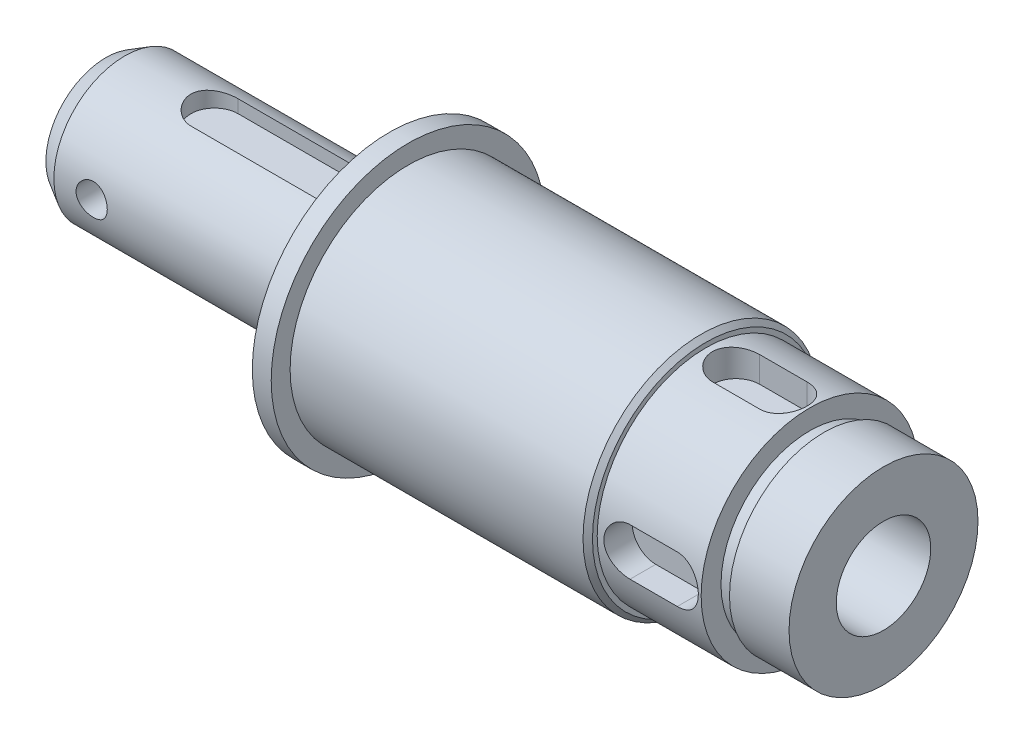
SolidWorks part; units mm, degrees
ref_plane "Face" through (0, 0, 0) normal (0, 0, 1) x (1, 0, 0)
ref_plane "Dessus" through (0, 0, 0) normal (0, 1, 0) x (1, 0, 0)
ref_plane "Droite" through (0, 0, 0) normal (1, 0, 0) x (0, 0, -1)
sketch "Esquisse1" plane through (0, 0, 0) normal (0, 0, 1) x (1, 0, 0)
  line L0 (0, 0) -> (61.8909, 0) construction
  line L1 (0, 5) -> (0, 7.5)
  line L2 (0, 5) -> (82.3, 5)
  line L3 (76, 10) -> (82.3, 10)
  line L4 (82.3, 10) -> (82.3, 5)
  line L5 (32, 14.25) -> (32, 12.5)
  line L6 (76, 10) -> (76, 9.4)
  line L7 (74.5, 11.5) -> (74.5, 9.4)
  line L8 (32, 12.5) -> (63.5, 12.5)
  line L9 (63.5, 12.5) -> (63.5, 11.5)
  line L10 (63.5, 11.5) -> (74.5, 11.5)
  line L11 (0, 7.5) -> (25, 7.5)
  line L12 (76, 9.4) -> (74.5, 9.4)
  line L13 (25, 7.5) -> (25, 14.25)
  line L15 (25, 14.25) -> (32, 14.25)
  dimension "D2" = 15
  dimension "D3" = 25
  dimension "D4" = 10
  dimension "D5" = 20
  dimension "D6" = 11
  dimension "D7" = 31.5
  dimension "D8" = 25
  dimension "D9" = 23
  dimension "D10" = 1.5
  dimension "D11" = 7.8
  dimension "D12" = 18.8
  dimension "D13" = 32
  dimension "D14" = 28.5
revolve "Révolution1" add sketch "Esquisse1" angle 360 about L0
chamfer "Chanfrein2" distance 0.5 angle 45 1 edges at (63.5, 0, 12.5)
chamfer "Chanfrein3" distance 2 angle 30 1 edges at (0, 0, 7.5)
chamfer "Chanfrein4" distance 2 angle 45 1 edges at (25, 0, 14.25)
sketch "Esquisse3" plane through (32, 0, 0) normal (1, 0, 0) x (0, 0, -1)
  circle A0 centre (0, 0) radius 12.5
  circle A1 centre (0, 0) radius 12.5 construction
sketch "Esquisse4" plane through (32, 0, 0) normal (1, 0, 0) x (0, 0, -1)
  circle A0 centre (0, 0) radius 14.25
  circle A1 centre (0, 0) radius 14.25 construction
  circle A2 centre (0, 0) radius 7.5
  circle A3 centre (0, 0) radius 7.5 construction
extrude "Enlèv. mat.-Extru.2" cut sketch "Esquisse4" against normal through all
ref_plane "Plan1" through (0, -7.5, 0) normal (0, 1, 0) x (-1, 0, 0)
sketch "Esquisse5" plane through (0, -7.5, 0) normal (0, 1, 0) x (-1, 0, 0)
  line L0 (2.4891, 0) -> (-37.115, 0) construction
  line L1 (-26.5, 2.5) -> (-11.5, 2.5)
  line L2 (-11.5, -2.5) -> (-26.5, -2.5)
  line L5 (-32, -12.5) -> (-32, 12.5) construction
  arc A0 (-26.5, 2.5) -> (-26.5, -2.5) centre (-26.5, 0) ccw
  arc A2 (-11.5, -2.5) -> (-11.5, 2.5) centre (-11.5, 0) ccw
  dimension "D1" = 2.5
  dimension "D2" = 20
  dimension "D3" = 3
extrude "Enlèv. mat.-Extru.3" cut sketch "Esquisse5" along normal blind 1.8
mirror "Symétrie1" about plane through (0, 0, 0) normal (0, 1, 0) of "Enlèv. mat.-Extru.3"
sketch "Esquisse8" plane through (0, 0, 0) normal (0, 0, 1) x (1, 0, 0)
  line L0 (0, 6.3453) -> (0, -6.3453) construction
  circle A0 centre (6, 0) radius 1.65
  dimension "D1" = 3.3
  dimension "D2" = 6
extrude "Enlèv. mat.-Extru.4" cut sketch "Esquisse8" along normal through all
ref_plane "Plan2" through (0, -11.5, 0) normal (0, 1, 0) x (-1, 0, 0)
sketch "Esquisse9" plane through (0, -11.5, 0) normal (0, 1, 0) x (-1, 0, 0)
  line L0 (-81.2708, 0) -> (-57.5088, 0) construction
  line L3 (-71.7, 2.5) -> (-66.7, 2.5)
  line L4 (-71.7, -2.5) -> (-66.7, -2.5)
  line L11 (-63.5, 12) -> (-63.5, -12) construction
  arc A0 (-71.7, 2.5) -> (-71.7, -2.5) centre (-71.7, 0) ccw
  arc A1 (-66.7, -2.5) -> (-66.7, 2.5) centre (-66.7, 0) ccw
  dimension "D1" = 5
  dimension "D2" = 10
  dimension "D3" = 0.7
extrude "Enlèv. mat.-Extru.5" cut sketch "Esquisse9" along normal blind 3
mirror "Symétrie2" about plane through (0, 0, 0) normal (0, 1, 0) of "Enlèv. mat.-Extru.5"
ref_plane "Plan3" through (0, 0, 11.5) normal (0, 0, 1) x (1, 0, 0)
sketch "Esquisse10" plane through (0, 0, 11.5) normal (0, 0, 1) x (1, 0, 0)
  line L0 (81.1804, 0) -> (53.764, 0) construction
  line L1 (66.7, 2.5) -> (71.7, 2.5)
  line L2 (71.7, -2.5) -> (66.7, -2.5)
  line L4 (63.5, -12) -> (63.5, 12) construction
  arc A1 (71.7, -2.5) -> (71.7, 2.5) centre (71.7, 0) ccw
  arc A2 (66.7, 2.5) -> (66.7, -2.5) centre (66.7, 0) ccw
  dimension "D1" = 2.5
  dimension "D2" = 10
  dimension "D3" = 0.7
extrude "Enlèv. mat.-Extru.6" cut sketch "Esquisse10" against normal blind 3
mirror "Symétrie3" about plane through (0, 0, 0) normal (0, 0, 1) of "Enlèv. mat.-Extru.6"
sketch "Esquisse11" plane through (32, 0, 0) normal (-1, 0, 0) x (0, 0, 1)
  circle A0 centre (0, 0) radius 14.5
  circle A3 centre (0, 0) radius 7.5
  circle A4 centre (0, 0) radius 7.5 construction
  dimension "D1" = 29
extrude "Extrusion1" add sketch "Esquisse11" along normal blind 2
